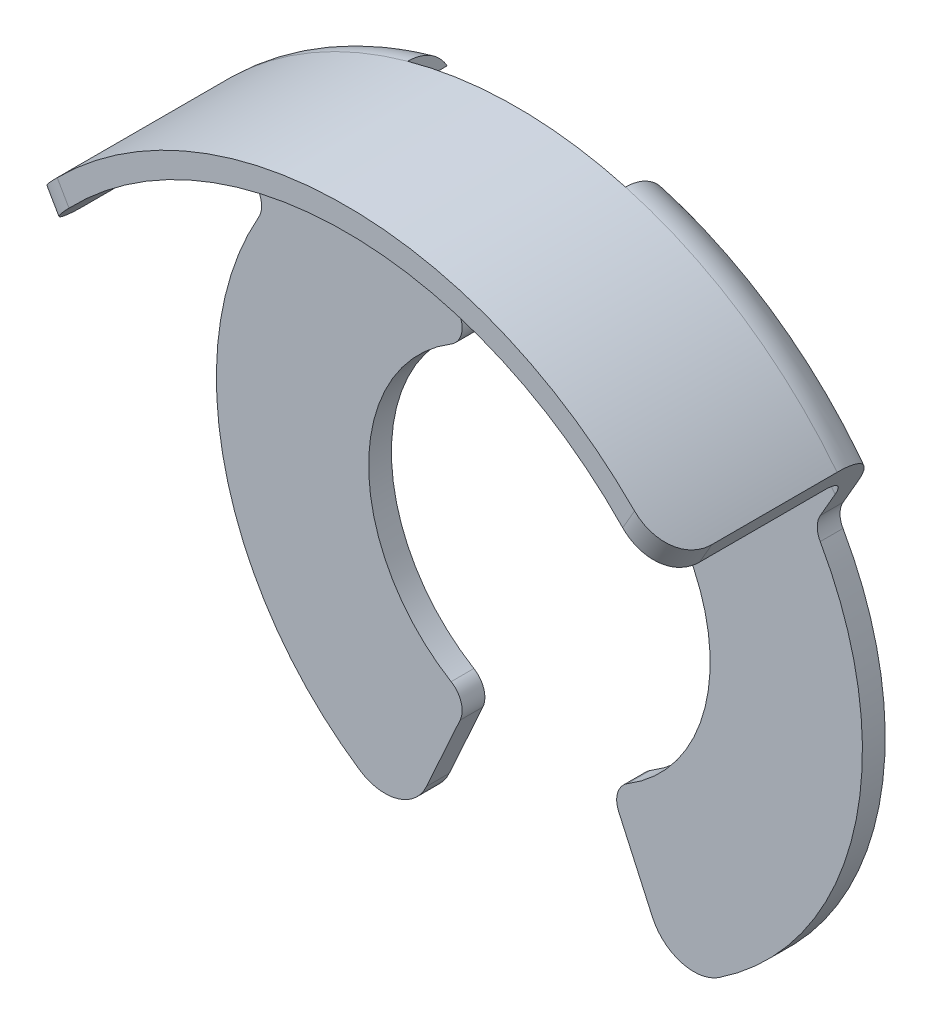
SolidWorks part; units mm, degrees
ref_plane "Front Plane" through (0, 0, 0) normal (0, 0, 1) x (1, 0, 0)
ref_plane "Top Plane" through (0, 0, 0) normal (0, 1, 0) x (1, 0, 0)
ref_plane "Right Plane" through (0, 0, 0) normal (1, 0, 0) x (0, 0, -1)
sketch "Sketch1" plane through (0, 0, 0) normal (0, 0, 1) x (1, 0, 0)
  circle A0 centre (0, 0) radius 6
  circle A1 centre (0, 0) radius 14.3
  dimension "D1" = 12
  dimension "D2" = 28.6
extrude "Boss-Extrude1" add sketch "Sketch1" against normal blind 7.6
sketch "Sketch2" plane through (0, 0, 0) normal (0, 0, 1) x (1, 0, 0)
  circle A0 centre (0, 0) radius 13.5
  dimension "D1" = 27
extrude "Cut-Extrude1" cut sketch "Sketch2" against normal blind 6.8
sketch "Sketch3" plane through (0, 0, 0) normal (0, 0, 1) x (1, 0, 0)
  line L0 (-11.2598, 8.8152) -> (-9.6344, 6)
  line L1 (11.2598, 8.8152) -> (9.6344, 6)
  circle A0 centre (0, 0) radius 14.3 construction
  arc A1 (-9.6344, 6) -> (9.6344, 6) centre (0, 0) ccw
  circle A2 centre (0, 0) radius 6 construction
  arc A4 (-11.2598, 8.8152) -> (11.2598, 8.8152) centre (0, 0) ccw
  point P7 (-11.35, 0)
  point P9 (11.35, 0)
  point P10 (0, 6)
  dimension "D1" = 60
  dimension "D2" = 22.7
extrude "Cut-Extrude2" cut sketch "Sketch3" against normal through all
sketch "Sketch4" plane through (0, 0, -6.8) normal (0, 0, 1) x (1, 0, 0)
  line L0 (0, 0) -> (-2.4764, -5.4651) construction
  line L1 (0, 0) -> (2.4764, -5.4651) construction
  line L2 (-2.4764, 5.4651) -> (-4.867, 10.7407)
  line L3 (0, 0) -> (-2.4764, 5.4651) construction
  line L4 (0, 0) -> (2.4764, 5.4651) construction
  line L5 (4.867, 10.7407) -> (2.4764, 5.4651)
  line L6 (2.4764, 5.4651) -> (2.4764, -5.4651) construction
  line L7 (-2.4764, 5.4651) -> (-2.4764, -5.4651) construction
  line L8 (-2.4764, -5.4651) -> (-3.9697, -8.7604)
  line L9 (2.4764, -5.4651) -> (3.9697, -8.7604)
  arc A0 (3.8681, 12.934) -> (-3.8681, 12.934) centre (0, 0) ccw
  arc A1 (10.8264, 8.0646) -> (-10.8264, 8.0646) centre (0, 0) ccw construction
  arc A2 (-2.4764, 5.4651) -> (-2.4764, -5.4651) centre (0, 0) ccw
  circle A3 centre (0, 0) radius 6 construction
  arc A4 (-4.867, 10.7407) -> (-3.8681, 12.934) centre (-3.4096, 11.4011) cw
  arc A6 (3.8681, 12.934) -> (4.867, 10.7407) centre (3.4096, 11.4011) cw
  arc A7 (-3.9697, -8.7604) -> (-6.3176, -9.4292) centre (-5.427, -8.1) cw
  arc A8 (-9.6344, 6) -> (9.6344, 6) centre (0, 0) ccw construction
  arc A9 (3.9697, -8.7604) -> (6.3176, -9.4292) centre (5.427, -8.1) ccw
  arc A10 (6.3176, -9.4292) -> (-6.3176, -9.4292) centre (0, 0) cw
  arc A11 (11.2598, 8.8152) -> (-11.2598, 8.8152) centre (0, 0) ccw construction
  arc A12 (2.4764, -5.4651) -> (2.4764, 5.4651) centre (0, 0) ccw
  point P1 (-5.427, -9.7)
  point P30 (5.427, -9.7)
  point P31 (0, 14.3)
  dimension "D2" = 1.6
  dimension "D1" = 24
extrude "Cut-Extrude3" cut sketch "Sketch4" against normal up to vertex
fillet "Fillet1" radius 1.6 3 edges at (0, 14.3, -7.6) (11.0431, 8.4399, 0) (-11.0431, 8.4399, 0)
fillet "Fillet2" radius 0.8 8 edges at (7.7402, 11.0607, -6.8) (-7.7402, 11.0607, -6.8) (-2.4764, -5.4651, -7.2) (2.4764, -5.4651, -7.2) (-2.4764, 5.4651, -7.2) (2.4764, 5.4651, -7.2) (-9.6344, 6, -7.2) (9.6344, 6, -7.2)
sketch "Sketch5" plane through (0, -4.5, -7.6) normal (0, 0, 1) x (1, 0, 0)
  line L0 (-3.8271, 12.9457) -> (-3.8271, 18.8)
  line L5 (3.8271, 12.9457) -> (3.8271, 18.8)
  line L6 (3.8271, 12.9457) -> (-3.8271, 12.9457)
  line L7 (2.7871, 10.6508) -> (4.867, 15.2407) construction
  line L8 (-4.867, 15.2407) -> (-2.7871, 10.6508) construction
  line L10 (-3.8271, 18.8) -> (3.8271, 18.8)
  arc A0 (11.2598, 13.3152) -> (-11.2598, 13.3152) centre (0, 4.5) ccw construction
extrude "Cut-Extrude5" cut sketch "Sketch5" along normal blind 1.6
